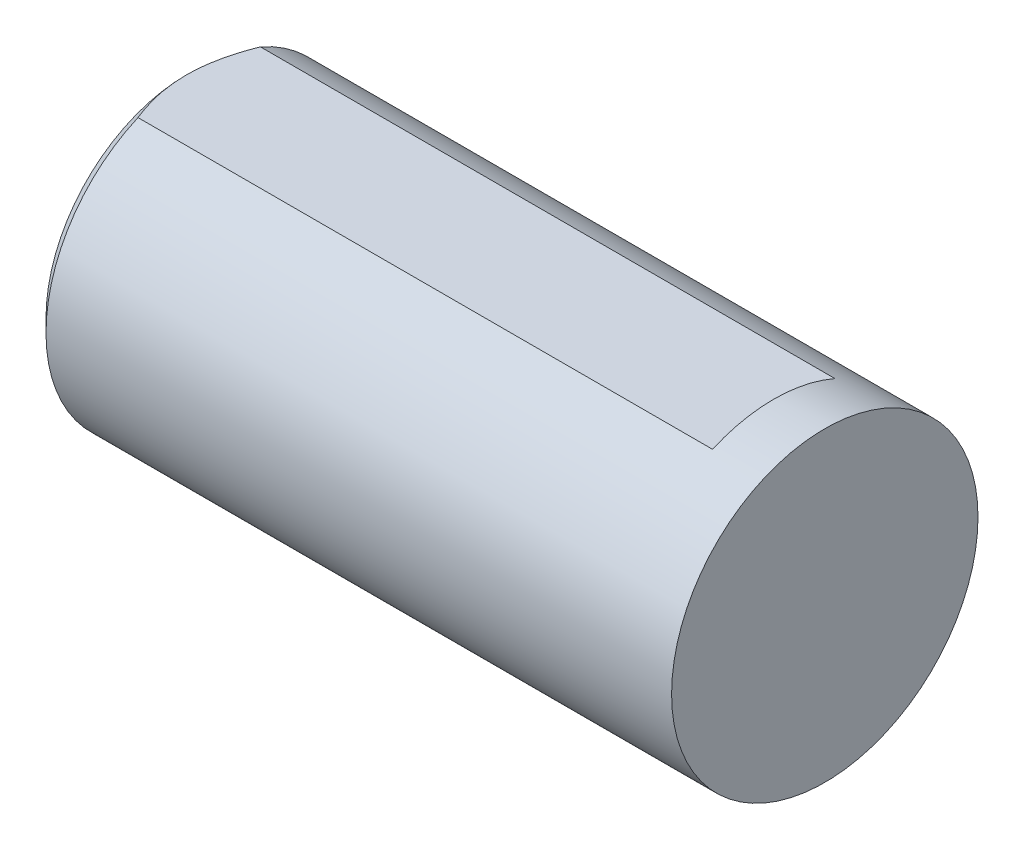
SolidWorks part; units mm, degrees
ref_plane "Plan1" through (0, 0, 0) normal (0, 0, 1) x (1, 0, 0)
ref_plane "Plan2" through (0, 0, 0) normal (0, 1, 0) x (1, 0, 0)
ref_plane "Plan3" through (0, 0, 0) normal (1, 0, 0) x (0, 0, -1)
sketch "Esquisse1" plane through (0, 0, 0) normal (0, 0, 1) x (1, 0, 0)
  line L0 (-25, 0) -> (-25, 6)
  line L1 (-25, 6) -> (0, 6)
  line L2 (0, 6) -> (0, 0)
  line L5 (0, 0) -> (-40, 0) construction
  line L6 (-25, 0) -> (0, 0)
  dimension "D1" = 25
  dimension "D2" = 12
revolve "Base-Révolution" add sketch "Esquisse1" angle 360 about L5
sketch "Esquisse2" plane through (-25, 0, 0) normal (-1, 0, 0) x (0, 0, 1)
  line L0 (-2.3979, 5.5) -> (2.3979, 5.5)
  line L1 (-9.2026, -6) -> (17.2549, -6) construction
  circle A0 centre (0, 0) radius 6 construction
  arc A1 (2.3979, 5.5) -> (-2.3979, 5.5) centre (0, 0) ccw
  dimension "D1" = 11.5
extrude "Enlèv. mat.-Extru.1" cut sketch "Esquisse2" against normal blind 23
chamfer "Chanfrein1" distance 0.5 angle 45
